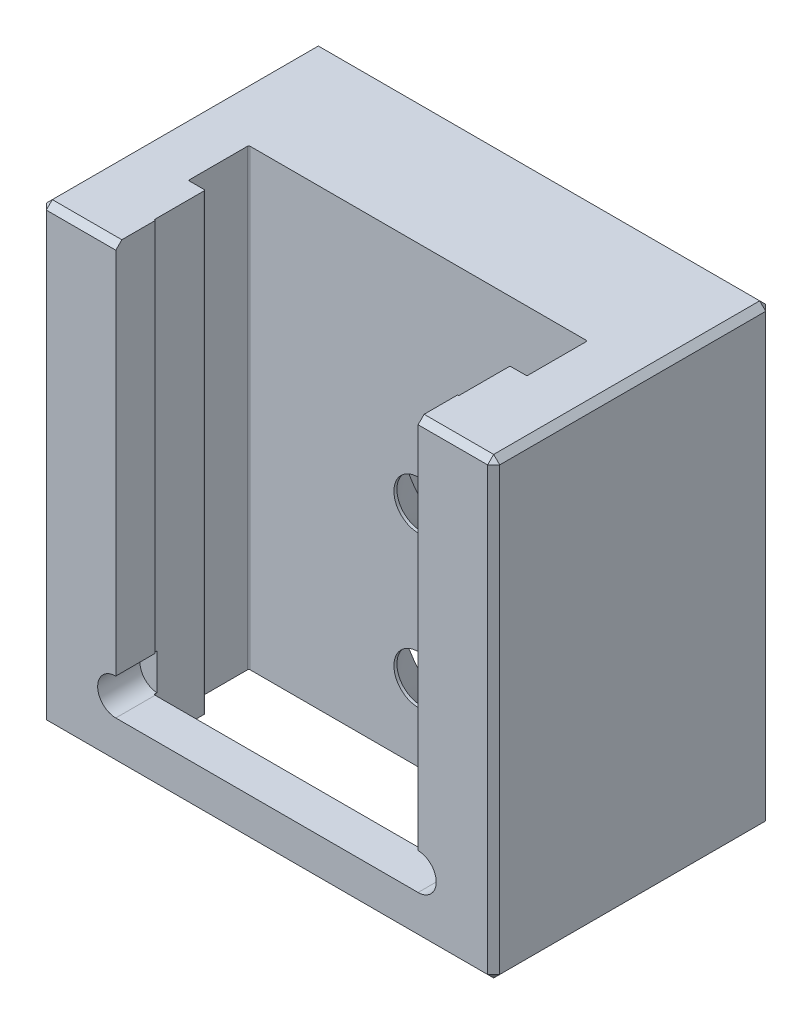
SolidWorks part; units mm, degrees
ref_plane "Plan de face" through (0, 0, 0) normal (0, 0, 1) x (1, 0, 0)
ref_plane "Plan de dessus" through (0, 0, 0) normal (0, 1, 0) x (1, 0, 0)
ref_plane "Plan de droite" through (0, 0, 0) normal (1, 0, 0) x (0, 0, -1)
sketch "Esquisse1" plane through (0, 0, 0) normal (0, 0, 1) x (1, 0, 0)
  line L1 (-37.5, -37.5) -> (37.5, -37.5)
  line L2 (-37.5, -37.5) -> (-37.5, 37.5)
  line L3 (-37.5, 37.5) -> (37.5, 37.5)
  line L4 (37.5, -37.5) -> (37.5, 37.5)
  dimension "D1" = 75
  dimension "D2" = 75
  dimension "D3" = 37.5
  dimension "D4" = 37.5
extrude "Bloc de base 75 x75 ep 61" add sketch "Esquisse1" along normal blind 46
chamfer "Cassages d'angles bloc" distance 1 angle 45 12 edges at (0, -37.5, 0) (37.5, 0, 0) (0, 37.5, 0) (-37.5, 0, 0) (0, 37.5, 46) (-37.5, 37.5, 23) (-37.5, 0, 46) (-37.5, -37.5, 23) (0, -37.5, 46) (37.5, -37.5, 23) (37.5, 0, 46) (37.5, 37.5, 23)
sketch "Esquisse2" plane through (0, 37.5, 0) normal (0, 1, 0) x (1, 0, 0)
  line L0 (0, 0) -> (0, -46) construction
  line L1 (36.5, -46) -> (-36.5, -46) construction
  line L2 (25.2, -31) -> (28, -31)
  line L3 (-28, -31) -> (-25.2, -31)
  line L4 (-28, -31) -> (-28, -21)
  line L5 (-28, -21) -> (28, -21)
  line L6 (28, -31) -> (28, -21)
  line L8 (-25.2, -31) -> (-25.2, -39.5)
  line L9 (-25.2, -39.5) -> (25.2, -39.5)
  line L10 (25.2, -31) -> (25.2, -39.5)
  dimension "D1" = 56
  dimension "D2" = 25
  dimension "D3" = 10
  dimension "D4" = 6.5
  dimension "D5" = 50.4
extrude "Ouverture passage cassette" cut sketch "Esquisse2" against normal through all
sketch "Esquisse3" plane through (0, 0, 46) normal (0, 0, 1) x (1, 0, 0)
  line L0 (-36.5, 37.5) -> (36.5, 37.5) construction
  line L1 (-25, 37.5) -> (25, 37.5)
  line L2 (-25, 37.5) -> (-25, -30.5)
  line L3 (-25, -30.5) -> (25, -30.5)
  line L4 (25, 37.5) -> (25, -30.5)
  line L5 (0, 0) -> (0, 37.5) construction
  line L6 (36.5, -37.5) -> (-36.5, -37.5) construction
  dimension "D1" = 50
  dimension "D2" = 7
extrude "Ouverture positionnement empreinte" cut sketch "Esquisse3" against normal up to surface (6.5 mm away)
fillet "cassages d'angles cassette" radius 0.2 8 edges at (-25.2, 0, 39.5) (25.2, 0, 39.5) (25.2, 0, 31) (28, 0, 31) (28, 0, 21) (-28, 0, 21) (-28, 0, 31) (-25.2, 0, 31)
sketch "Esquisse4" plane through (0, 0, 46) normal (0, 0, 1) x (1, 0, 0)
  line L0 (-25, 36.5) -> (-25, -30.5) construction
  line L1 (25, -30.5) -> (25, 36.5) construction
  line L2 (-25, -30.5) -> (25, -30.5) construction
  circle A0 centre (-25, -27.5) radius 3
  circle A1 centre (25, -27.5) radius 3
  dimension "D1" = 6
extrude "Dégagements pour butée cassette" cut sketch "Esquisse4" against normal blind 7
sketch "Esquisse5" plane through (0, 0, 0) normal (0, 0, -1) x (-1, 0, 0)
  line L0 (-20, 0) -> (-20, -37.5)
  line L1 (36.5, -37.5) -> (-36.5, -37.5) construction
  line L2 (20, 0) -> (20, -37.5)
  line L3 (20, -37.5) -> (-20, -37.5)
  arc A0 (20, 0) -> (-20, 0) centre (0, 0) ccw
  dimension "D1" = 40
extrude "Dégagement passage tête d'injection" cut sketch "Esquisse5" against normal blind 10
chamfer "cassage d'angles" distance 1 angle 45 3 edges at (-20, -18.25, 0) (0, 20, 0) (20, -18.25, 0)
sketch "Esquisse6" plane through (0, 0, 10) normal (0, 0, -1) x (-1, 0, 0)
  line L0 (-36.5, -37.5) -> (36.5, -37.5) construction
  line L1 (0, 0) -> (0, 37.5) construction
  line L3 (-27.8, 37.5) -> (27.8, 37.5) construction
  circle A0 centre (0, 0) radius 4
  dimension "D1" = 8
  dimension "D2" = 37.5
extrude "passage buse position centrale" cut sketch "Esquisse6" against normal through all
chamfer "dégagement buse" distance 10.5 angle 45 1 edges at (-4, 0, 10)
sketch "Esquisse7" plane through (0, 0, 10) normal (0, 0, -1) x (-1, 0, 0)
  line L0 (-36.5, -37.5) -> (36.5, -37.5) construction
  circle A0 centre (0, -25) radius 4
  dimension "D1" = 8
  dimension "D2" = 12.5
extrude "passage buse position basse" cut sketch "Esquisse7" against normal through all
chamfer "dégagement buse basse" distance 10.5 angle 45 1 edges at (-4, -25, 10)
hole_wizard "Trous taraudés M6 de fixation" positions "Esquisse9" profile "Esquisse8" tap size "M6" standard "Iso"
sketch "Esquisse9" plane through (0, 0, 0) normal (0, 0, -1) x (-1, 0, 0)
  line L0 (-36.5, 37.5) -> (36.5, 37.5) construction
  line L1 (-37.5, -36.5) -> (-37.5, 36.5) construction
  point P0 (-31.5, 31.5)
  dimension "D1" = 6
  dimension "D2" = 6
sketch "Esquisse8" plane through (31.5, 31.5, 0) normal (1, 0, 0) x (0, 1, 0)
  line L0 (0, 0) -> (0, 26.5022)
  line L1 (0, 26.5022) -> (2.5, 25)
  line L2 (2.5, 25) -> (2.5, 1)
  line L3 (2.5, 1) -> (3.5, 0)
  line L5 (3.5, 0) -> (0, 0)
  line L6 (-2.5, 1) -> (-3.5, 0) construction
  line L10 (0, 26.5022) -> (-2.5, 25) construction
  line L11 (0, -6.35) -> (0, 107.95) construction
  dimension "Diamètre du trou pour taraudage" = 5
  dimension "Profondeur du trou pour taraudage" = 25
  dimension "Diamètre du fraisage entrant" = 7
  dimension "Angle du fraisage entrant" = 90
  dimension "Angle de pointe" = 118
pattern_linear "Répétition linéaire1" count 2 spacing 63 along (-1, 0, 0) count 2 spacing 63 along (0, -1, 0) of "Trous taraudés M6 de fixation"
